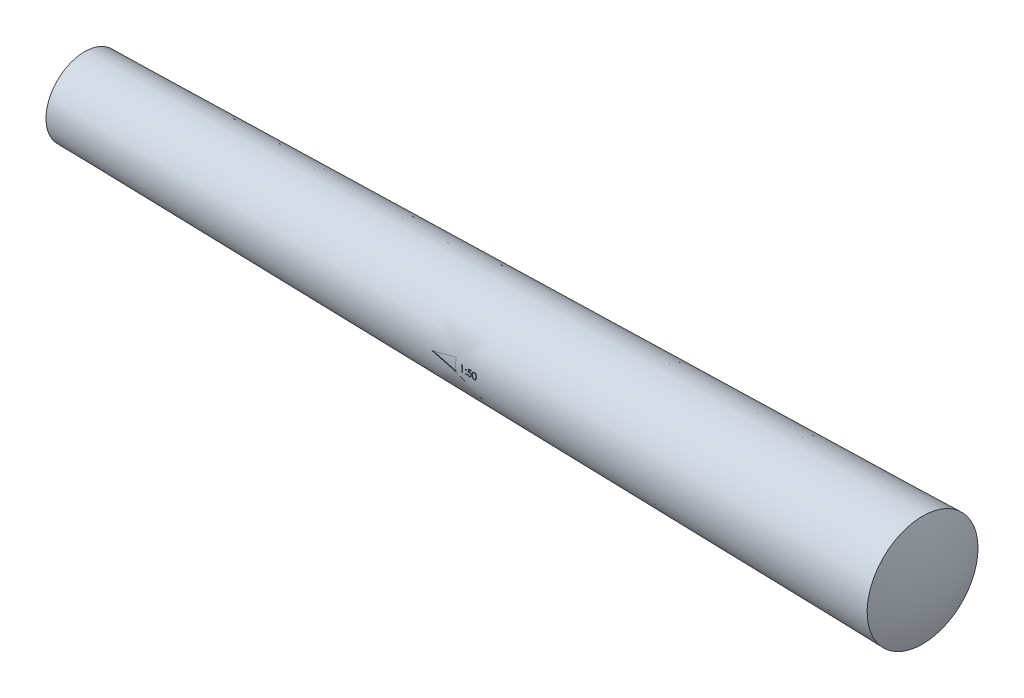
SolidWorks part; units mm, degrees
ref_plane "Front Plane" through (0, 0, 0) normal (0, 0, 1) x (1, 0, 0)
ref_plane "Top Plane" through (0, 0, 0) normal (0, 1, 0) x (1, 0, 0)
ref_plane "Right Plane" through (0, 0, 0) normal (1, 0, 0) x (0, 0, -1)
sketch "Sketch1" plane through (0, 0, 0) normal (1, 0, 0) x (0, 0, -1)
  circle A0 centre (0, 0) radius 6
  dimension "D1" = 12
extrude "Extrude1" add sketch "Sketch1" along normal mid plane 130
draft "Draft1" type of draft neutral plane draft angle 1.146 faces to draft 1 parameters "D1"=1.146
sketch "Sketch2" plane through (0, 0, 0) normal (0, 0, 1) x (1, 0, 0)
  line L0 (-65, 0) -> (-65, 6)
  line L1 (-65, 6) -> (-65, -6) construction
  line L2 (-65, 0) -> (-66.6, 0)
  line L3 (-66.6, 0) -> (-66.6, -7.3) construction
  line L4 (65, 0) -> (65, 8.6001)
  line L5 (65, -8.6001) -> (65, 8.6001) construction
  line L6 (65, 0) -> (66.6, 0)
  line L7 (66.6, 0) -> (66.6, -7.3) construction
  line L8 (-65, -6) -> (65, -8.6001) construction
  arc A0 (-66.6, 0) -> (-65, 6) centre (-54.55, 0) cw
  arc A1 (66.6, 0) -> (65, 8.6001) centre (42.687, 0) ccw
  point P14 (0, -7.3)
revolve "Revolve1" add sketch "Sketch2" angle 360 about L2
sketch "Sketch5" plane through (0, 0, 0) normal (0, 0, 1) x (1, 0, 0)
  line L0 (0, 7.3) -> (0, -7.3) construction
  line L1 (65, 8.6001) -> (-65, 6) construction
  line L2 (-65, -6) -> (65, -8.6001) construction
ref_plane "Plane2" through (0, 0, 0) normal (-0.02, 0, 0.9998) x (0.9998, 0, 0.02)
sketch "Sketch6" plane through (0, 0, 0) normal (-0.02, 0, 0.9998) x (0.9998, 0, 0.02)
  line L0 (0, 0) -> (0, 1)
  line L1 (0, 7.3) -> (0, -7.3) construction
  line L2 (0, 1) -> (-3.7321, 0)
  line L3 (-3.7321, 0) -> (0, -1)
  line L4 (0, -1) -> (0, 0)
  line L5 (0, -0.5) -> (4, -0.5) construction
  text T0 "1:50" font "Century Gothic" height 1
  dimension "D1" = 2
  dimension "D2" = 30
  dimension "D3" = 4
wrap "Wrap2" sketch "Sketch6" wrap type deboss source sketch "Sketch6" thickness 0.1 parameters "D1"=0.1
equation "\"D2@Sketch2\" = \"D1@Sketch2\""
